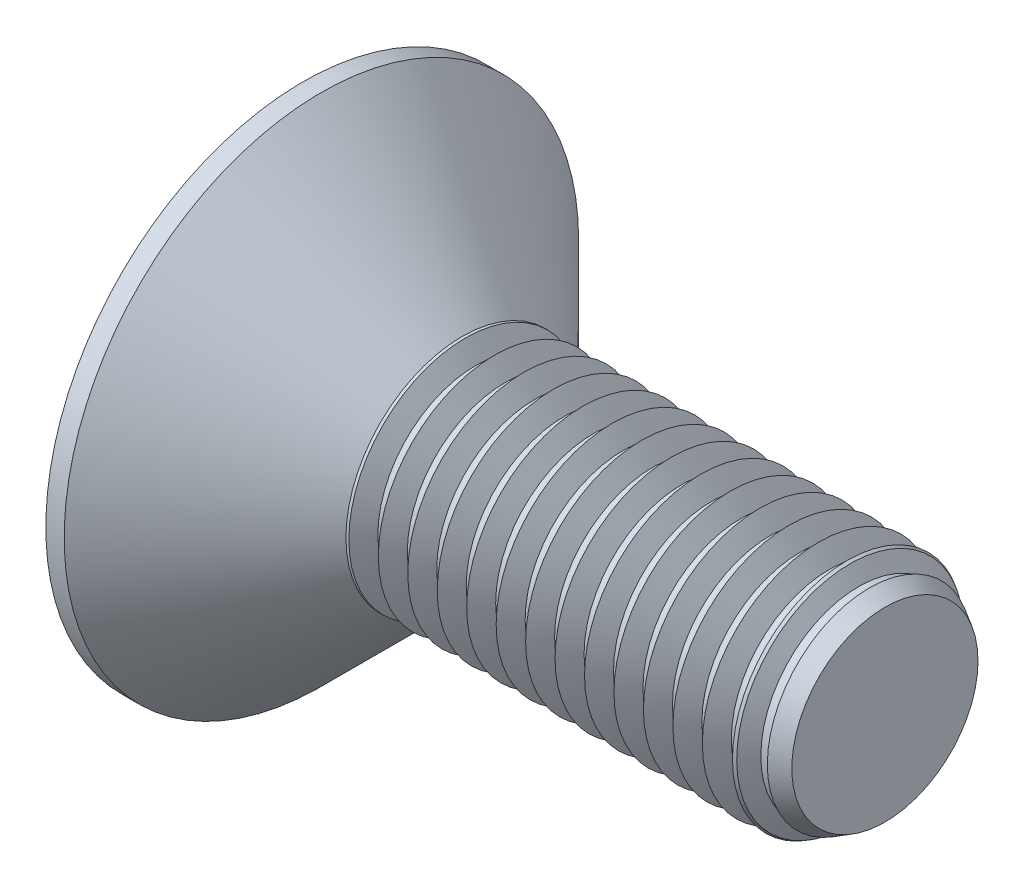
SolidWorks part; units mm, degrees
ref_plane "Front" through (0, 0, 0) normal (0, 0, 1) x (1, 0, 0)
ref_plane "Top" through (0, 0, 0) normal (0, 1, 0) x (1, 0, 0)
ref_plane "Right" through (0, 0, 0) normal (1, 0, 0) x (0, 0, -1)
sketch "Sketch1" plane through (0, 0, 0) normal (0, 0, 1) x (1, 0, 0)
  line L0 (0, 4.2) -> (0.3, 4.2)
  line L1 (0.3, 4.2) -> (2.6, 1.9)
  line L2 (2.6, 1.9) -> (9.5, 1.9)
  line L3 (9.5, 1.9) -> (9.5, 0)
  line L4 (9.5, 0) -> (0, 0)
  line L5 (0, 0) -> (0, 4.2)
  line L6 (6.6207, 0) -> (-0.9387, 0) construction
revolve "Revolve1" add sketch "Sketch1" angle 360 about L6
chamfer "Chamfer1" distance 0.38 angle 60 1 edges at (9.5, 0, -1.9)
sketch "Sketch9" plane through (0, 0, 0) normal (0, 0, 1) x (1, 0, 0)
  line L0 (2.9558, 1.6) -> (2.8213, 1.6)
  line L1 (2.8213, 1.6) -> (2.6481, 1.9)
  line L2 (2.9558, 1.6) -> (3.129, 1.9)
  line L3 (2.6481, 1.9) -> (2.6481, 2.15)
  line L4 (3.129, 1.9) -> (3.129, 2.15)
  line L5 (2.6481, 2.15) -> (3.129, 2.15)
  line L6 (2.8886, 1.6) -> (2.8886, 0) construction
  line L7 (0, 0) -> (7.3035, 0) construction
  line L8 (2.6, 1.9) -> (2.6, -1.9) construction
  line L9 (8.8418, 1.9) -> (2.6, 1.9) construction
revolve "ThreadSchematic" cut sketch "Sketch9" angle 360 about L7
pattern_linear "ThdSchPat" count 15 spacing 0.4809 along (1, 0, 0) of "ThreadSchematic"
sketch "Sketch3" plane through (0, 0, 0) normal (0, 0, 1) x (1, 0, 0)
  line L0 (2.6, 1.9) -> (9.5, 1.9) construction
  line L2 (7.5, 1.9) -> (8, 1.9) construction
  line L3 (9.5, 1.9) -> (9.5, 0) construction
  line L4 (8, 1.9) -> (9.5, 1.9)
  line L5 (2.9, 0) -> (5.4301, 0) construction
  line L6 (9.5, 0) -> (9.7, 0)
  line L7 (9.7, 0) -> (9.7, 1.9)
  line L8 (9.7, 1.9) -> (9.5, 1.9)
  line L9 (8, 1.9) -> (9.5, 0)
revolve "EndCone" [suppressed] cut sketch "Sketch3" angle 360 about L5
sketch "Sketch4" plane through (0, 0, 0) normal (-1, 0, 0) x (0, 0, 1)
  line L0 (-0.25, 1) -> (-0.25, 0.25)
  line L1 (-0.25, 1) -> (0.25, 1)
  line L2 (-1, 0.25) -> (-1, -0.25)
  line L3 (-0.25, -1) -> (0.25, -1)
  line L4 (1, 0.25) -> (1, -0.25)
  line L5 (0.25, 1) -> (0.25, 0.25)
  line L6 (0.25, 0.25) -> (1, 0.25)
  line L7 (0.25, -0.25) -> (1, -0.25)
  line L8 (0.25, -0.25) -> (0.25, -1)
  line L9 (-0.25, -0.25) -> (-0.25, -1)
  line L10 (-0.25, -0.25) -> (-1, -0.25)
  line L11 (-0.25, 0.25) -> (-1, 0.25)
  line L12 (1, 0) -> (-1, 0) construction
extrude "Cut-Extrude1" cut sketch "Sketch4" against normal blind 1.2
draft "Draft1" type of draft neutral plane draft angle 35 faces to draft 4 parameters "D1"=35
draft "Draft2" type of draft neutral plane draft angle 8 faces to draft 8 parameters "D1"=8
sketch "Sketch6" plane through (1.2, 0, 0) normal (-1, 0, 0) x (0, 0, 1)
  line L0 (0.0814, 0.0814) -> (0.0814, 0.1598) construction
  line L1 (0.1598, 0.0814) -> (0.0814, 0.0814) construction
  line L2 (-0.0814, 0.1598) -> (-0.0814, 0.0814) construction
  line L3 (-0.0814, 0.0814) -> (-0.1598, 0.0814) construction
  line L4 (-0.1598, -0.0814) -> (-0.0814, -0.0814) construction
  line L5 (-0.0814, -0.0814) -> (-0.0814, -0.1598) construction
  line L6 (0.0814, -0.1598) -> (0.0814, -0.0814) construction
  line L7 (0.0814, -0.0814) -> (0.1598, -0.0814) construction
  line L9 (-0.1206, 0.0814) -> (-0.1206, -0.0814)
  line L10 (-0.0814, -0.1206) -> (0.0814, -0.1206)
  line L11 (0.1206, -0.0814) -> (0.1206, 0.0814)
  line L12 (0.0814, 0.1206) -> (-0.0814, 0.1206)
  arc A0 (0.0814, 0.1206) -> (0.1206, 0.0814) centre (0.1206, 0.1206) ccw
  arc A1 (-0.0814, 0.1206) -> (-0.1206, 0.0814) centre (-0.1206, 0.1206) cw
  arc A2 (-0.1206, -0.0814) -> (-0.0814, -0.1206) centre (-0.1206, -0.1206) cw
  arc A3 (0.0814, -0.1206) -> (0.1206, -0.0814) centre (0.1206, -0.1206) cw
sketch "Sketch7" plane through (0, 0, 0) normal (-1, 0, 0) x (0, 0, 1)
  line L8 (0.25, 0.25) -> (0.25, 1) construction
  line L9 (1, 0.25) -> (0.25, 0.25) construction
  line L10 (0.25, -0.25) -> (1, -0.25) construction
  line L11 (0.25, -1) -> (0.25, -0.25) construction
  line L12 (-0.25, 1) -> (-0.25, 0.25) construction
  line L13 (-0.25, 0.25) -> (-1, 0.25) construction
  line L14 (-1, -0.25) -> (-0.25, -0.25) construction
  line L15 (-0.25, -0.25) -> (-0.25, -1) construction
  line L16 (0.2892, 0.25) -> (0.2892, -0.25)
  line L17 (0.25, -0.2892) -> (-0.25, -0.2892)
  line L18 (-0.2892, -0.25) -> (-0.2892, 0.25)
  line L19 (-0.25, 0.2892) -> (0.25, 0.2892)
  arc A0 (0.25, 0.2892) -> (0.2892, 0.25) centre (0.2892, 0.2892) ccw
  arc A1 (-0.25, 0.2892) -> (-0.2892, 0.25) centre (-0.2892, 0.2892) cw
  arc A2 (-0.2892, -0.25) -> (-0.25, -0.2892) centre (-0.2892, -0.2892) cw
  arc A3 (0.0814, 0.1206) -> (0.1206, 0.0814) centre (0.1206, 0.1206) ccw construction
  arc A4 (0.2892, -0.25) -> (0.25, -0.2892) centre (0.2892, -0.2892) ccw
loft "Cut-Loft1" cut profiles "Sketch6", "Sketch7"
sketch "Sketch8" plane through (0, 0, 0) normal (-1, 0, 0) x (0, 0, 1)
  line L0 (0, 0) -> (1, 1) construction
  line L1 (0.0814, 0.1206) -> (1, 1)
  line L2 (1, 1) -> (0.1206, 0.0814)
  line L3 (0.25, 1) -> (1, 1) construction
  line L4 (1, 1) -> (1, 0.25) construction
  line L5 (0, 0) -> (0.1206, 0) construction
  line L6 (0.1206, 0.0814) -> (0.1206, 0)
  line L7 (0.0814, 0.1206) -> (0, 0.1206)
  line L8 (0, 0.1206) -> (0, 0) construction
  line L9 (0.0814, -0.1206) -> (0, -0.1206)
  line L10 (1, -1) -> (0.0814, -0.1206)
  line L11 (0.1206, -0.0814) -> (1, -1)
  line L12 (0.1206, -0.0814) -> (0.1206, 0)
  line L13 (-0.1206, -0.0814) -> (-0.1206, 0)
  line L14 (-1, -1) -> (-0.1206, -0.0814)
  line L15 (-0.0814, -0.1206) -> (-1, -1)
  line L16 (-0.0814, -0.1206) -> (0, -0.1206)
  line L17 (-0.0814, 0.1206) -> (0, 0.1206)
  line L18 (-1, 1) -> (-0.0814, 0.1206)
  line L19 (-0.1206, 0.0814) -> (-1, 1)
  line L20 (-0.1206, 0.0814) -> (-0.1206, 0)
  arc A1 (0.0814, 0.1206) -> (0.1206, 0.0814) centre (0.1206, 0.1206) ccw construction
  arc A2 (0.0814, 0.1206) -> (0.1206, 0.0814) centre (0.1206, 0.1206) ccw construction
extrude "TypeZ" [suppressed] cut sketch "Sketch8" against normal blind 0.24 draft 3
equation "\"D1@Chamfer1\" = \"d@Sketch1\" / 10"
equation "\"D1@Sketch4\" = \"m@Sketch4\" / 4"
equation "\"D1@TypeZ\" = \"p@Cut-Extrude1\"*0.2"
equation "\"D1@Sketch3\" = \"y@Sketch3\" / 4"
equation "\"threadstart@Sketch9\"=\"advance@Sketch9\"*0.6"
equation "\"D1@ThdSchPat\" = int(((\"l@Sketch1\"-\"k@Sketch1\")/\"advance@Sketch9\") + 0.999)"
equation "\"D3@ThdSchPat\" = \"advance@Sketch9\""
equation "\"minordia@Sketch9\" = \"D2@ThreadCosmetic\""
